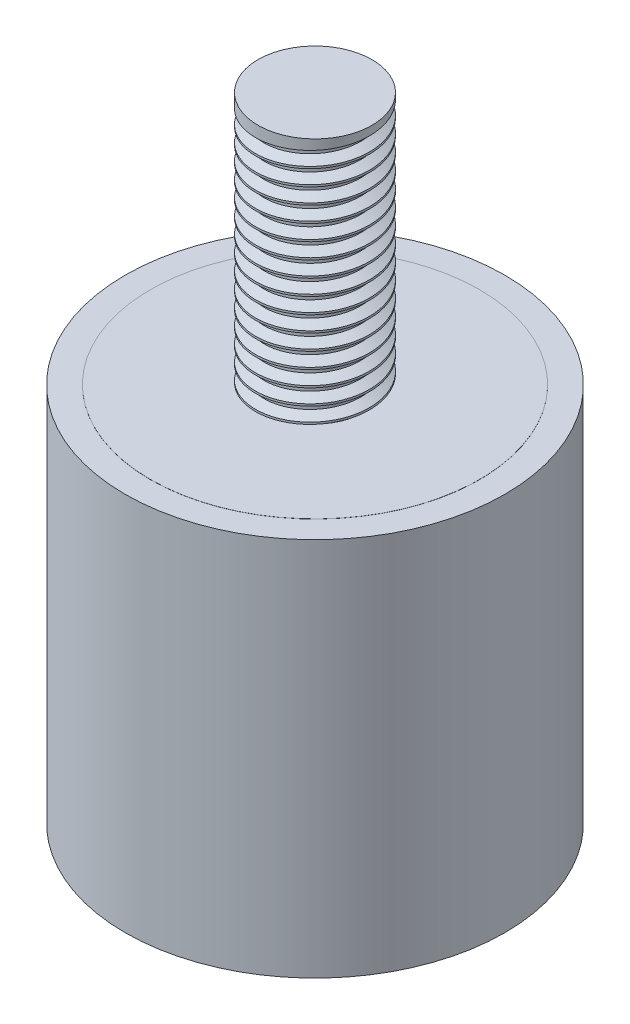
SolidWorks part; units mm, degrees
ref_plane "Front Plane" through (0, 0, 0) normal (0, 0, 1) x (1, 0, 0)
ref_plane "Top Plane" through (0, 0, 0) normal (0, 1, 0) x (1, 0, 0)
ref_plane "Right Plane" through (0, 0, 0) normal (1, 0, 0) x (0, 0, -1)
sketch "Sketch1" plane through (0, 0, 0) normal (0, 1, 0) x (1, 0, 0)
  circle A0 centre (0, 0) radius 15
  dimension "D1" = 30
extrude "Boss-Extrude1" add sketch "Sketch1" along normal blind 30
sketch "Sketch2" plane through (0, 30, 0) normal (0, 1, 0) x (1, 0, 0)
  circle A0 centre (0, 0) radius 4.5
  dimension "D1" = 9
extrude "Boss-Extrude2" add sketch "Sketch2" along normal blind 20
thread "Thread2" pitch 1.25 start angle 0, offset 0, length 20, pitch 1.25, diameter 9
ref_plane "Plane2" through (-4.5, 50, 0) normal (0, 0, 1) x (-1, 0, 0)
sketch "Thread Profile2" plane through (-4.5, 50, 0) normal (0, 0, 1) x (-1, 0, 0)
  line L0 (0, 0) -> (0, 1.25) construction
  line L11 (0, 0) -> (0, 1.0937)
  line L12 (0, 1.0937) -> (-0.6766, 0.7031)
  line L13 (-0.6766, 0.7031) -> (-0.6766, 0.3906)
  line L15 (-0.6766, 0.3906) -> (0, 0)
  line L17 (-0.6766, 0.5469) -> (0, 0.5469) construction
  point P2 (0, 0)
  dimension "Pitch" = 1.25
  dimension "Profile_Angle" = 60
  dimension "Profile_Land" = 0.3125
  dimension "Profile_Height" = 0.6766
sketch "Sketch11" plane through (0, 30, 0) normal (0, 1, 0) x (1, 0, 0)
  circle A0 centre (0, 0) radius 13
extrude "Boss-Extrude3" add sketch "Sketch11" along normal blind 0.01 contours A0
